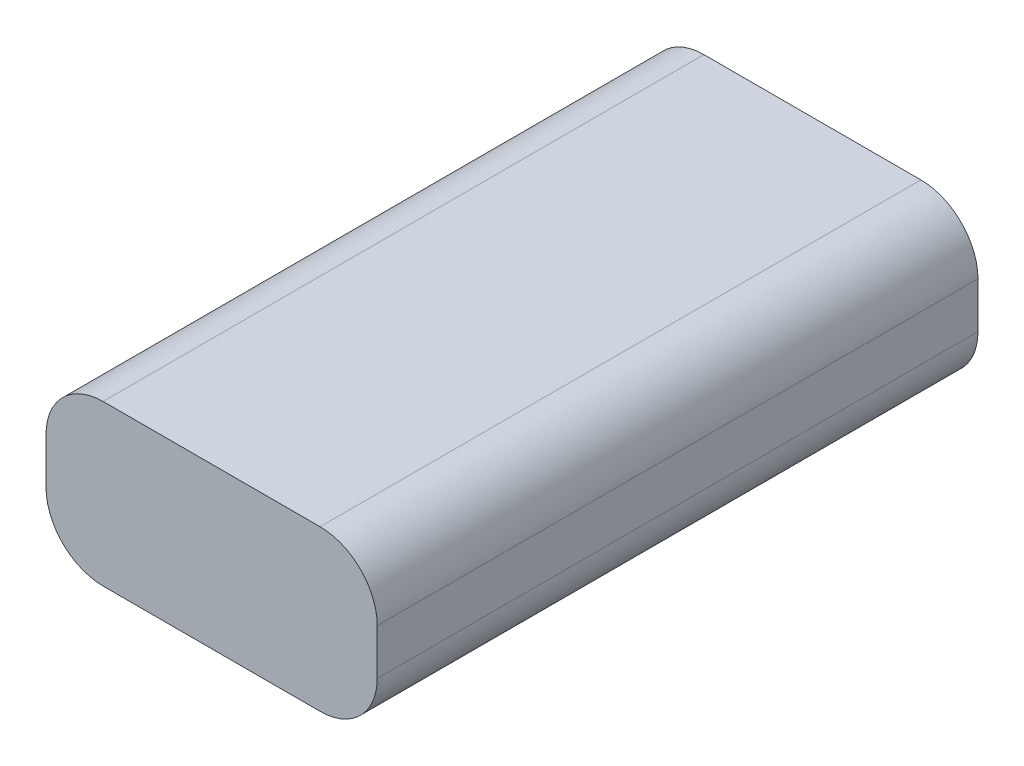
SolidWorks part; units mm, degrees
ref_plane "Front Plane" through (0, 0, 0) normal (0, 0, 1) x (1, 0, 0)
ref_plane "Top Plane" through (0, 0, 0) normal (0, 1, 0) x (1, 0, 0)
ref_plane "Right Plane" through (0, 0, 0) normal (1, 0, 0) x (0, 0, -1)
sketch "Sketch1" plane through (0, 0, 0) normal (0, 1, 0) x (1, 0, 0)
  line L1 (18.415, -33.401) -> (-18.415, -33.401)
  line L2 (18.415, -33.401) -> (18.415, 33.401)
  line L3 (18.415, 33.401) -> (-18.415, 33.401)
  line L4 (-18.415, -33.401) -> (-18.415, 33.401)
  line L5 (18.415, -33.401) -> (-18.415, 33.401) construction
  line L6 (18.415, 33.401) -> (-18.415, -33.401) construction
  point P0 (0, 0)
  dimension "D1" = 36.83
  dimension "D2" = 66.802
extrude "Boss-Extrude1" add sketch "Sketch1" along normal blind 17.78
fillet "Fillet1" radius 6.35 4 edges at (18.415, 0, 0) (18.415, 17.78, 0) (-18.415, 0, 0) (-18.415, 17.78, 0)
